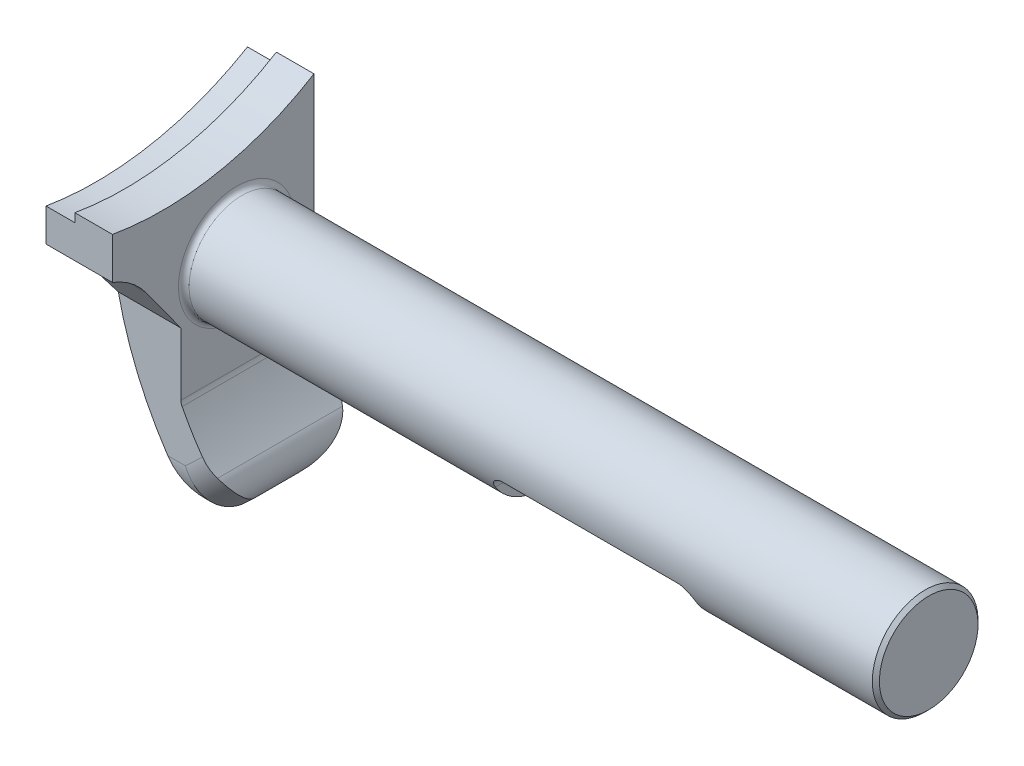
SolidWorks part; units mm, degrees
ref_plane "Front Plane" through (0, 0, 0) normal (0, 0, 1) x (1, 0, 0)
ref_plane "Top Plane" through (0, 0, 0) normal (0, 1, 0) x (1, 0, 0)
ref_plane "Right Plane" through (0, 0, 0) normal (1, 0, 0) x (0, 0, -1)
sketch "Sketch2" plane through (0, 0, 0) normal (0, 0, 1) x (1, 0, 0)
  line L0 (0, 11.6153) -> (0, 0) construction
  line L1 (4.759, 0) -> (58.0166, 0) construction
  line L2 (54.3052, 0) -> (54.3052, 3.5306)
  line L3 (54.0512, 3.7846) -> (4.759, 3.7846)
  line L4 (4.759, 3.7846) -> (4.759, -3.3846)
  line L5 (4.759, 0) -> (54.3052, 0)
  line L6 (54.3052, 3.5306) -> (54.0512, 3.7846)
  point P5 (54.3052, 3.7846)
  dimension "D1" = 7.5692
  dimension "D2" = 54.3052
revolve "Revolve1" add sketch "Sketch2" angle 360 about L1
sketch "Sketch3" plane through (0, 0, 0) normal (0, 0, 1) x (1, 0, 0)
  line L0 (4.759, -3.7846) -> (54.0512, -3.7846) construction
  line L1 (26.476, -3.7846) -> (40.954, -3.7846)
  line L2 (26.476, -3.7846) -> (26.476, -2.032)
  line L3 (27.492, -1.016) -> (39.938, -1.016)
  line L4 (40.954, -3.7846) -> (40.954, -2.032)
  line L5 (4.759, 3.7846) -> (4.759, -3.3846) construction
  line L6 (4.759, 0) -> (54.3052, 0) construction
  arc A0 (39.938, -1.016) -> (40.954, -2.032) centre (39.938, -2.032) cw
  arc A1 (26.476, -2.032) -> (27.492, -1.016) centre (27.492, -2.032) cw
  dimension "D4" = 1.016
  dimension "D1" = 36.195
  dimension "D2" = 14.478
  dimension "D3" = 1.016
extrude "Cut-Extrude1" cut sketch "Sketch3" against normal through all both and the other way through all
sketch "Sketch5" plane through (0, 0, 0) normal (0, 0, 1) x (1, 0, 0)
  line L0 (4.759, 9.5374) -> (4.759, -7.112)
  line L1 (4.759, 0) -> (54.3052, 0) construction
  line L2 (4.759, -7.112) -> (7.9197, -7.112) construction
  line L3 (4.759, 9.5374) -> (0.127, 9.5374)
  line L4 (0, 11.6153) -> (0, 0) construction
  line L5 (0, 9.4104) -> (0, -10.4449)
  line L6 (6.3444, -14.1925) -> (6.8941, -13.6726)
  arc A0 (4.759, -7.112) -> (4.8443, -7.4622) centre (5.521, -7.112) ccw
  arc A1 (0, -1.1043) -> (6.3444, -14.1925) centre (23.876, 2.3876) ccw
  arc A2 (4.8443, -7.4622) -> (7.0896, -10.9332) centre (23.876, 2.3876) ccw
  arc A3 (6.8941, -13.6726) -> (7.0896, -10.9332) centre (5.4979, -12.1963) ccw
  arc A4 (0.127, 9.5374) -> (0, 9.4104) centre (0.127, 9.4104) ccw
  point P21 (0, 9.5374)
  dimension "D2" = 0.762
  dimension "D3" = 24.13
  dimension "D6" = 2.032
  dimension "D7" = 0.127
  dimension "D1" = 7.112
  dimension "D4" = 2.3876
  dimension "D5" = 23.876
extrude "Boss-Extrude2" add sketch "Sketch5" along normal mid plane 17.78 contours L3 A4 L5 A1 L6 A3 A2 A0 L0
sketch "Sketch6" plane through (0, 0, 0) normal (-1, 0, 0) x (0, 0, 1)
  line L0 (0, 11.4389) -> (0, -14.1925) construction
  line L1 (8.89, -14.1925) -> (-8.89, -14.1925) construction
  line L2 (-9.324, 0) -> (3.9878, 0) construction
  line L3 (3.9878, -2.6353) -> (6.5022, 0.8254)
  line L4 (-5.5372, 8.364) -> (-5.5372, -11.0175)
  line L5 (-10.4464, 19.2592) -> (12.4856, 19.2592)
  line L6 (-10.4464, 19.2592) -> (-10.4464, -15.9251)
  line L7 (-10.4464, -15.9251) -> (12.4856, -15.9251)
  line L8 (12.4856, 19.2592) -> (12.4856, -15.9251)
  line L10 (0.8128, -14.1925) -> (-2.3622, -14.1925)
  line L11 (8.89, 5.6196) -> (8.89, 2.6416)
  line L12 (-9.324, -2.2352) -> (18.0458, -2.2352) construction
  line L13 (-9.324, -2.2352) -> (8.89, -2.2352) construction
  line L14 (3.9878, -2.6353) -> (3.9878, -11.0175)
  line L16 (-9.324, 0) -> (8.89, 0) construction
  arc A0 (-5.5372, 8.364) -> (8.89, 5.6196) centre (5.3086, 26.0858) ccw
  arc A2 (6.5022, 0.8254) -> (8.89, 2.6416) centre (10.7147, -2.2352) cw
  arc A3 (3.9878, -11.0175) -> (0.8128, -14.1925) centre (0.8128, -11.0175) cw
  arc A4 (-2.3622, -14.1925) -> (-5.5372, -11.0175) centre (-2.3622, -11.0175) cw
  point P27 (3.9878, -14.1925)
  point P30 (-5.5372, -14.1925)
  dimension "D1" = 20.7772
  dimension "D8" = 4.7752
  dimension "D10" = 5.207
  dimension "D11" = 3.175
  dimension "D2" = 26.0858
  dimension "D3" = 5.3086
  dimension "D4" = 5.5372
  dimension "D6" = 8.89
  dimension "D9" = 36
  dimension "D5" = 9.525
  dimension "D7" = 2.2352
extrude "Cut-Extrude2" cut sketch "Sketch6" against normal blind 17.78
fillet "Fillet1" radius 0.381 1 edges at (4.759, -3.7846, 0)
fillet "Fillet3" radius 3.175 3 edges at (7.5285, -12.1229, -5.3386) (6.4848, -14.0598, -3.2706) (7.1218, -10.9749, -5.5372)
fillet "Fillet4" radius 3.175 3 edges at (7.5127, -12.4595, 3.6414) (7.1218, -10.9749, 3.9878) (6.4848, -14.0598, 1.7212)
sketch "Sketch7" plane through (0, 0, 0) normal (-1, 0, 0) x (0, 0, 1)
  line L0 (-5.5372, 8.364) -> (-5.5372, 7.6531)
  line L2 (8.89, 5.001) -> (8.89, 5.6196)
  arc A1 (-5.5372, 8.364) -> (8.89, 5.6196) centre (5.3086, 26.0858) ccw construction
  arc A2 (-5.8554, 7.8441) -> (8.9951, 5.0191) centre (5.3086, 26.0858) ccw
  arc A3 (-5.5372, 7.6531) -> (8.89, 5.001) centre (5.3086, 26.0858) ccw
  arc A4 (-5.5372, 8.364) -> (8.89, 5.6196) centre (5.3086, 26.0858) ccw
  dimension "D1" = 0.6096
extrude "Cut-Extrude3" cut sketch "Sketch7" against normal offset from surface (2.0666 mm away) 2.6924
